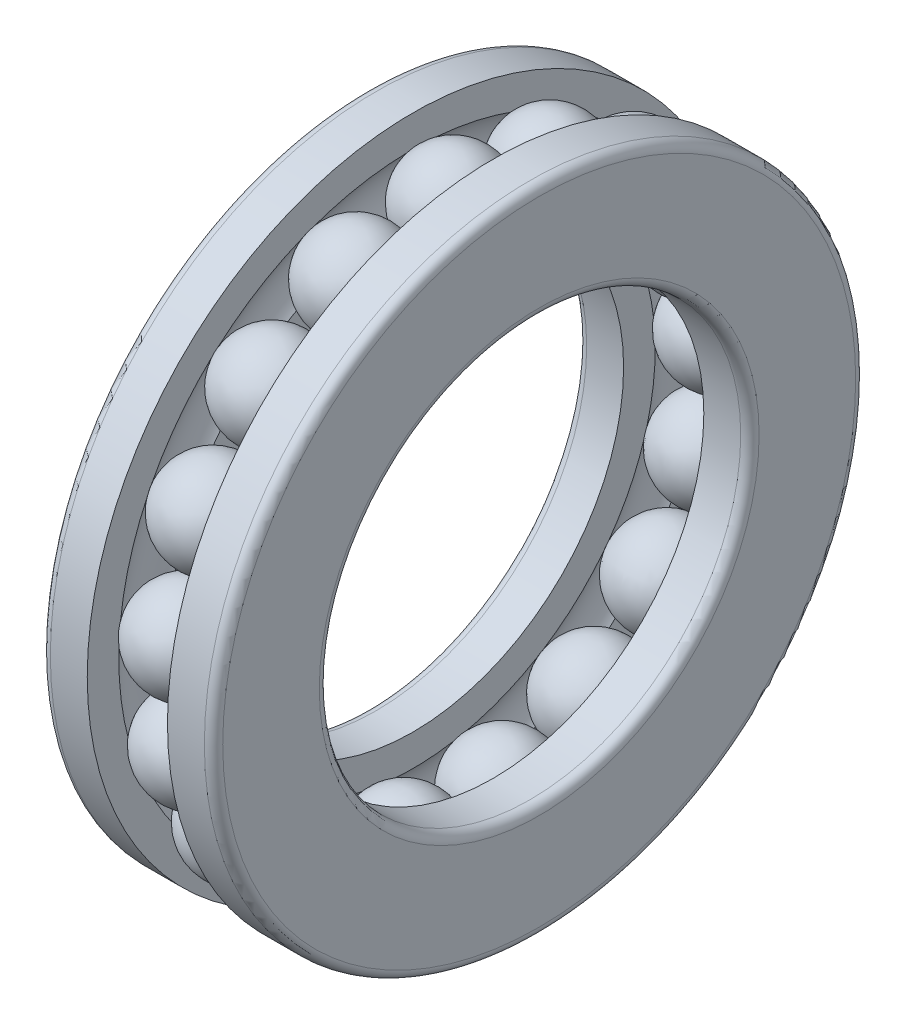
SolidWorks part; units mm, degrees
ref_plane "Plane1" through (0, 0, 0) normal (0, 0, 1) x (1, 0, 0)
ref_plane "Plane2" through (0, 0, 0) normal (0, 1, 0) x (1, 0, 0)
ref_plane "Plane3" through (0, 0, 0) normal (1, 0, 0) x (0, 0, -1)
other "Configuration Table"
sketch "Clipboard" plane through (0, 0, 0) normal (0, 0, 1) x (1, 0, 0)
  line L0 (-10, 0) -> (10, 0) construction
  line L1 (0, 0) -> (21.3836, -6.5376)
  line L2 (0, 0) -> (27.3662, 35.0271)
  line L3 (0, 0) -> (13.7666, -17.6205)
  line L4 (0, 0) -> (-22.3471, -0.7804)
sketch "InnRacSke" plane through (0, 0, 0) normal (0, 0, 1) x (1, 0, 0)
  line L0 (-6.6469, 40.1581) -> (-6.6469, 34.925)
  line L1 (-6.6469, 34.925) -> (-12.7635, 34.925)
  line L2 (-14.2875, 36.449) -> (-14.2875, 52.451)
  line L3 (-12.7635, 53.975) -> (-6.6469, 53.975)
  line L4 (-6.6469, 53.975) -> (-6.6469, 48.7419)
  line L5 (-34.925, 0) -> (34.925, 0) construction
  line L6 (0, 0) -> (0, 25.4) construction
  arc A0 (-12.7635, 34.925) -> (-14.2875, 36.449) centre (-12.7635, 36.449) cw
  arc A1 (-14.2875, 52.451) -> (-12.7635, 53.975) centre (-12.7635, 52.451) cw
  arc A2 (-6.6469, 48.7419) -> (-6.6469, 40.1581) centre (0, 44.45) ccw
revolve "Race" add sketch "InnRacSke" angle 360 about L5
ref_axis "Axis1" through (-50, 0, 0) along (1, 0, 0)
sketch "BalDetSke" plane through (0, 0, 0) normal (0, 0, 1) x (1, 0, 0)
  line L0 (-7.9375, 44.45) -> (7.9375, 44.45)
  line L1 (-14.5732, 44.45) -> (14.5732, 44.45) construction
  arc A0 (7.9375, 44.45) -> (-7.9375, 44.45) centre (0, 44.45) cw
revolve "BallDetailed" add sketch "BalDetSke" angle 360 about L1
sketch "BalSimSke" plane through (0, 0, 0) normal (0, 0, 1) x (1, 0, 0)
  line L0 (-25.4, 0) -> (25.4, 0) construction
  circle A0 centre (0, 44.45) radius 7.9375
revolve "BallsSimplified" [suppressed] add sketch "BalSimSke" angle 360 about L0
mirror "Mirror1" about plane through (0, 0, 0) normal (1, 0, 0) of "Race"
pattern_circular "BallsDetailed" count 17 every 21.176 about axis through (-50, 0, 0) along (1, 0, 0) of "BallDetailed"
sketch "CagSpiSke" plane through (0, 0, 0) normal (0, 0, 1) x (1, 0, 0)
  line L0 (1.9844, 35.7188) -> (1.9844, 53.1812)
  line L1 (1.9844, 53.1812) -> (-1.9844, 53.1812)
  line L2 (-1.9844, 53.1812) -> (-1.9844, 35.7188)
  line L3 (-1.9844, 35.7188) -> (1.9844, 35.7188)
  line L4 (-34.925, 0) -> (34.925, 0) construction
  line L5 (0, 0) -> (0, 50.8) construction
revolve "CageSpine" [suppressed] add sketch "CagSpiSke" angle 360 about L4
equation "\"BallCLRad@Clipboard\" =  ( \"OD@InnRacSke\" + \"ID@InnRacSke\" )  / 4"
equation "\"BallCLRad@BalSimSke\" = \"BallCLRad@Clipboard\""
equation "\"BallCLRad@BalDetSke\" = \"BallCLRad@Clipboard\""
equation "\"BallCLRad@InnRacSke\" = \"BallCLRad@Clipboard\""
equation "\"Ball_diameter@InnRacSke\" = \"Ball_diameter@BalDetSke\" - 0.002"
equation "\"Ball_diameter@BalSimSke\" = \"Ball_diameter@BalDetSke\""
equation "\"Max_count@Clipboard\" = int( 3.14159265 / atn(( \"Ball_diameter@BalDetSke\" / 2) / sqr( \"BallCLRad@Clipboard\"  *  \"BallCLRad@Clipboard\" - ( \"Ball_diameter@BalDetSke\" / 2) *  ( \"Ball_diameter@BalDetSke\" "
equation "\"Max_count@Clipboard\" = ((sgn( \"Max_count@Clipboard\" - \"Count@Clipboard\" )-1)*( \"Max_count@Clipboard\" - \"Count@Clipboard\" ))/-2+ \"Count@Clipboard\""
equation "\"Count@BallsDetailed\" = int( \"Show_count@Clipboard\" ) "
equation "\"Count@BallsDetailed\" = ((sgn( \"Count@BallsDetailed\" - \"Max_count@Clipboard\" )-1)*( \"Count@BallsDetailed\" - \"Max_count@Clipboard\" ))/-2+ \"Max_count@Clipboard\""
equation "\"Count@BallsDetailed\" = ((sgn( \"Count@BallsDetailed\" - \"Min_count@Clipboard\" )+1)*( \"Count@BallsDetailed\" - \"Min_count@Clipboard\"))/2 +\"Min_count@Clipboard\""
equation "\"Angle@BallsDetailed\" = 360.0 / \"Max_count@Clipboard\""
equation "\"Angle@CageSpine\" =  \"Angle@BallsDetailed\" * ( \"Count@BallsDetailed\" -1 + int( \"Count@BallsDetailed\" / \"Max_count@Clipboard\" ) )  + 0.001 -  int( \"Count@BallsDetailed\" / \"Max_count@Clipboard\" ) * 0.00"
equation "\"Angle@CageSpine\" =  \"Angle@CageSpine\" * int( \"Min_count@Clipboard\" / 2) + int(1 / \"Min_count@Clipboard\")  * 0.001"
equation "\"Thickness@CagSpiSke\" =  \"Ball_diameter@BalDetSke\" * 0.25"
equation "\"OD@CagSpiSke\" = ( \"OD@InnRacSke\" + ( \"BallCLRad@Clipboard\" * 2 + \"Ball_diameter@BalDetSke\" )) / 2"
equation "\"ID@CagSpiSke\" = ( \"ID@InnRacSke\" + ( \"BallCLRad@Clipboard\" * 2 - \"Ball_diameter@BalDetSke\" )) / 2"
